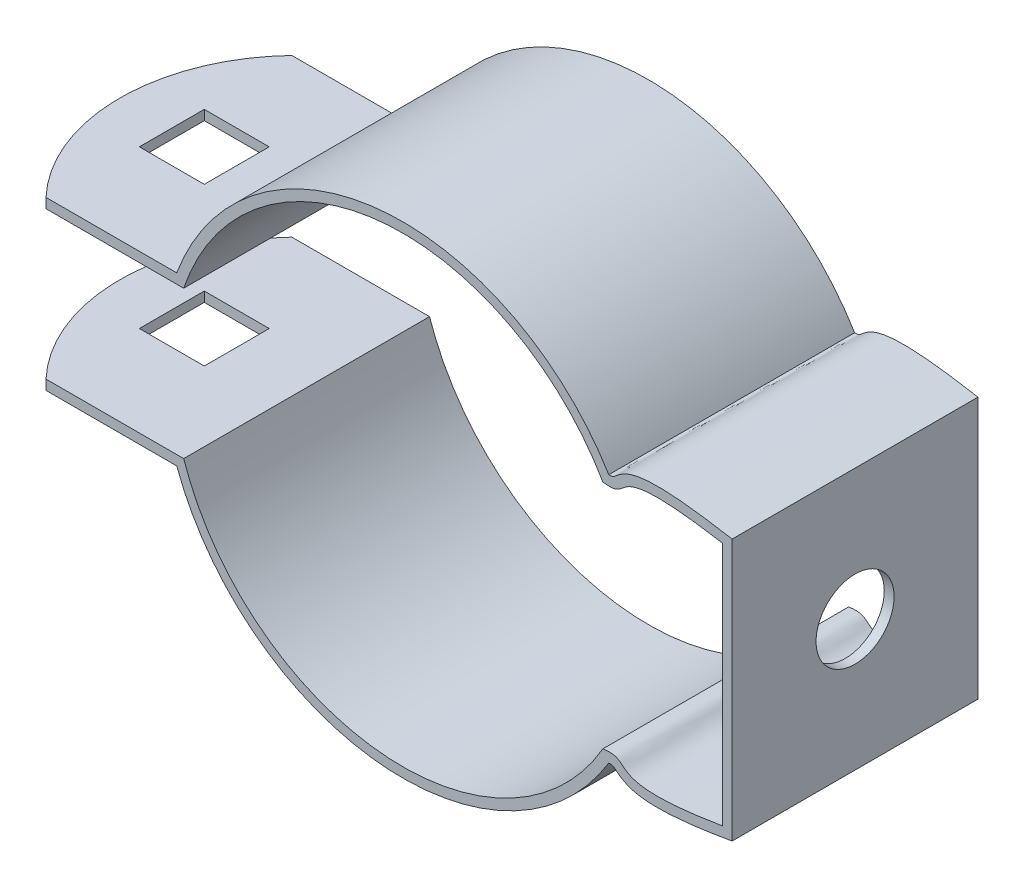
SolidWorks part; units mm, degrees
ref_plane "Front" through (0, 0, 0) normal (0, 0, 1) x (1, 0, 0)
ref_plane "Top" through (0, 0, 0) normal (0, 1, 0) x (1, 0, 0)
ref_plane "Right" through (0, 0, 0) normal (1, 0, 0) x (0, 0, -1)
sketch "Sketch1" plane through (0, 0, 0) normal (0, 0, 1) x (1, 0, 0)
  line L0 (2.5097, 0) -> (-11.4903, 0) construction
  line L1 (-22.2711, 7.5) -> (-36.2711, 7.5)
  line L2 (-22.2711, -7.5) -> (-36.2711, -7.5)
  line L3 (32.5, 12.453) -> (32.5, -12.453)
  line L4 (-22.9783, -8.5) -> (-36.2711, -8.5)
  line L5 (33.5, 13.298) -> (33.5, -13.298)
  line L6 (-22.9783, 8.5) -> (-36.2711, 8.5)
  line L7 (2.5097, 1) -> (-11.4903, 1)
  line L8 (-36.2711, 7.5) -> (-36.2711, 8.5)
  line L9 (-36.2711, -7.5) -> (-36.2711, -8.5)
  arc A0 (20.3516, 11.75) -> (-22.2711, 7.5) centre (0, 0) ccw
  arc A1 (-22.2711, -7.5) -> (20.3516, -11.75) centre (0, 0) ccw
  arc A2 (-22.9783, -8.5) -> (20.9558, -12.6927) centre (0, 0) ccw
  arc A3 (20.9558, 12.6927) -> (-22.9783, 8.5) centre (0, 0) ccw
  spline S0 degree 3 poles (20.3516, 11.75) (23.8433, 11.2164) (20.0291, 14.5626) (32.5, 12.453) knots 0 0 0 0 0.859078 0.859078 0.859078 0.859078
  spline S1 degree 3 poles (20.3516, -11.75) (23.8433, -11.2164) (20.0291, -14.5626) (32.5, -12.453) knots 0 0 0 0 0.859078 0.859078 0.859078 0.859078
  spline S2 degree 1 poles (20.9558, -12.6927) (33.5, -13.298) knots 0 0 1 1 construction
  spline S3 degree 1 poles (20.9558, 12.6927) (33.5, 13.298) knots 0 0 1 1 construction
  spline S4 degree 3 poles (20.9558, -12.6927) (21.0056, -12.6911) (21.1154, -12.6914) (21.2546, -12.7051) (21.3496, -12.7308) (21.4161, -12.7626) (21.578, -12.8712) (21.9932, -13.2484) (22.9264, -13.7887) (24.3012, -14.1157) (25.9682, -14.1877) (27.7554, -14.0923) (29.3574, -13.9332) (30.9341, -13.7194) (32.3662, -13.4916) (33.1257, -13.3614) (33.5, -13.298) knots 0.053315 0.053315 0.053315 0.053315 0.079093 0.104871 0.156427 0.207983 0.259539 0.362651 0.465763 0.568875 0.671987 0.723543 0.775099 0.826655 0.852432 0.87821 0.87821 0.87821 0.87821
  spline S5 degree 3 poles (33.5, 13.298) (33.1257, 13.3614) (32.3662, 13.4916) (30.9341, 13.7194) (29.3574, 13.9332) (27.7554, 14.0923) (25.9682, 14.1877) (24.3012, 14.1157) (22.9264, 13.7887) (21.9932, 13.2484) (21.578, 12.8712) (21.4161, 12.7626) (21.3496, 12.7308) (21.2546, 12.7051) (21.1154, 12.6914) (21.0056, 12.6911) (20.9558, 12.6927) knots 0.053315 0.053315 0.053315 0.053315 0.079093 0.104871 0.156427 0.207983 0.259539 0.362651 0.465763 0.568875 0.671987 0.723543 0.775099 0.826655 0.852432 0.87821 0.87821 0.87821 0.87821
  point P14 (32.5, 0)
  dimension "D1" = 47
  dimension "D7" = 1
  dimension "D2" = 15
  dimension "D3" = 14
  dimension "D5" = 12.453
extrude "Boss-Extrude1" add sketch "Sketch1" along normal blind 25 contours L5 S5 A3 L6 L8 L1 A0 S0 L3 S1 A1 L2 L9 L4 A2 S4
sketch "Sketch2" plane through (0, -8.5, 0) normal (0, -1, 0) x (1, 0, 0)
  line L0 (-36.2711, 25) -> (-36.2711, 0) construction
  line L1 (-36.2711, 12.5) -> (-41.2711, 12.5) construction
  line L2 (-36.2711, 25) -> (-36.2711, -6.358) construction
  line L3 (-36.2711, 25) -> (-36.2711, 0)
  arc A0 (-36.2711, 25) -> (-36.2711, 0) centre (-23.1461, 12.5) ccw
  dimension "D1" = 5
extrude "Boss-Extrude2" add sketch "Sketch2" against normal up to surface (16 mm away) contours A0 L3
mirror "Mirror1" about plane through (0, 0, 0) normal (0, 1, 0) of "Boss-Extrude2"
sketch "Sketch3" plane through (-36.2711, 0, 0) normal (1, 0, 0) x (0, 0, -1)
  line L1 (-25, 7.5) -> (0, 7.5)
  line L2 (-25, 7.5) -> (-25, -7.5)
  line L3 (-25, -7.5) -> (0, -7.5)
  line L4 (0, 7.5) -> (0, -7.5)
extrude "Cut-Extrude1" cut sketch "Sketch3" against normal blind 25
sketch "Sketch4" plane through (0, -8.5, 0) normal (0, -1, 0) x (1, 0, 0)
  line L1 (-35.9783, 15.802) -> (-29.3743, 15.802)
  line L2 (-35.9783, 15.802) -> (-35.9783, 9.198)
  line L3 (-35.9783, 9.198) -> (-29.3743, 9.198)
  line L4 (-29.3743, 15.802) -> (-29.3743, 9.198)
  line L5 (-22.9783, 25) -> (-22.9783, 0) construction
  line L9 (-24.1943, 0) -> (-24.1943, 25) construction
  line L10 (-22.9783, 0) -> (-36.2711, 0) construction
  line L11 (-22.9783, 25) -> (-36.2711, 25) construction
  point P12 (-24.1943, 12.5)
  point P13 (-29.3743, 12.5)
  dimension "D1" = 6.604
  dimension "D2" = 13
  dimension "D3" = 6.604
extrude "Cut-Extrude2" cut sketch "Sketch4" against normal blind 25
sketch "Sketch6" plane through (33.5, 0, 0) normal (1, 0, 0) x (0, 0, -1)
  line L2 (-25, 0) -> (0, 0) construction
  line L3 (-25, 13.298) -> (-25, -13.298) construction
  line L4 (-12.5, 13.298) -> (-12.5, -13.298) construction
  line L5 (-25, 13.298) -> (0, 13.298) construction
  line L6 (-25, -13.298) -> (0, -13.298) construction
  circle A0 centre (-12.5, 0) radius 3.9688
  dimension "D1" = 7.9375
extrude "Cut-Extrude3" cut sketch "Sketch6" against normal blind 25
